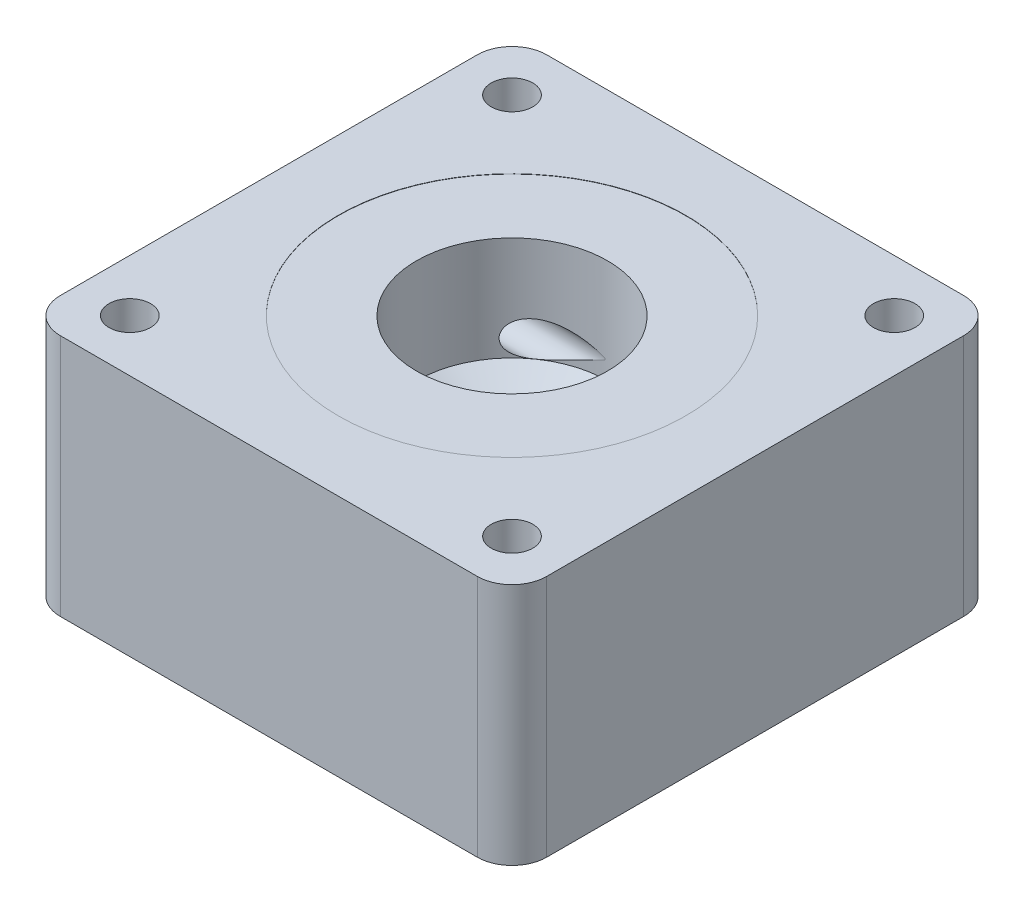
SolidWorks part; units mm, degrees
ref_plane "Front Plane" through (0, 0, 0) normal (0, 0, 1) x (1, 0, 0)
ref_plane "Top Plane" through (0, 0, 0) normal (0, 1, 0) x (1, 0, 0)
ref_plane "Right Plane" through (0, 0, 0) normal (1, 0, 0) x (0, 0, -1)
sketch "Sketch1" plane through (0, 0, 0) normal (0, 1, 0) x (1, 0, 0)
  line L1 (0, 0) -> (44.45, 0)
  line L2 (0, 0) -> (0, 44.45)
  line L3 (0, 44.45) -> (44.45, 44.45)
  line L4 (44.45, 0) -> (44.45, 44.45)
  dimension "D1" = 44.45
  dimension "D2" = 44.45
extrude "Boss-Extrude1" add sketch "Sketch1" along normal blind 22.225
hole_wizard "CSK for #6 Flat Head Socket Cap Screw1" positions "Sketch3" profile "Sketch2" countersink size "#6" standard "Ansi Inch"
sketch "Sketch3" plane through (11.91, 0, -3.9814) normal (0, 1, 0) x (-1, 0, 0)
  line L0 (11.91, -18.2436) -> (-32.54, -18.2436) construction
  line L1 (11.91, -40.4686) -> (11.91, 3.9814) construction
  line L2 (-32.54, 3.9814) -> (-32.54, -40.4686) construction
  line L3 (-10.315, 3.9814) -> (-10.315, -40.4686) construction
  line L4 (11.91, 3.9814) -> (-32.54, 3.9814) construction
  line L5 (-32.54, -40.4686) -> (11.91, -40.4686) construction
  point P0 (-27.7775, -35.7061)
  point P15 (7.1475, -35.7061)
  point P17 (-27.7775, -0.7811)
  point P18 (7.1475, -0.7811)
  dimension "D1" = 17.4625
  dimension "D2" = 17.4625
sketch "Sketch2" plane through (39.6875, 0, -39.6875) normal (1, 0, 0) x (0, 0, -1)
  line L0 (0, 0) -> (0, 22.225)
  line L1 (0, 22.225) -> (1.8986, 22.225)
  line L2 (1.8986, 22.225) -> (1.8986, 2.301)
  line L3 (1.8986, 2.301) -> (3.8989, 0)
  line L5 (3.8989, 0) -> (0, 0)
  line L6 (-1.8986, 2.301) -> (-3.8989, 0) construction
  line L11 (0, -6.35) -> (0, 107.95) construction
  dimension "Thru Hole Dia." = 3.7973
  dimension "Thru Hole Depth" = 22.225
  dimension "Near C'Sink Dia." = 7.7978
  dimension "Near C'Sink Angle" = 82
sketch "Sketch25" [suppressed] plane through (0, 19.1626, -22.3156) normal (1, 0, 0) x (0, 0, -1)
  line L0 (0, 3.175) -> (0, -3.175) construction
  line L1 (3.175, 0) -> (-3.175, 0) construction
  line L4 (-22.3156, 12.5874) -> (22.1344, 12.5874) construction
  point P5 (0, -3.2876)
  dimension "D1" = 15.875
  dimension "D3" = 6.35
ref_plane "Plane14" [suppressed] through (0, 15.875, -22.3156) normal (0, -1, 0) x (-1, 0, 0)
sketch "Port Sketch4" [suppressed] plane through (0, 15.875, -25.3729) normal (0, 1, 0) x (0, 0, 1)
  line L0 (3.0573, 0) -> (3.0573, 45.0293) construction
  line L1 (3.0573, 18.5806) -> (8.0179, 15.6)
  line L2 (8.0179, 15.6) -> (8.0179, 13.1)
  line L3 (8.0179, 13.1) -> (8.6136, 13.1)
  line L4 (8.6136, 13.1) -> (8.6136, 4.1104)
  line L5 (8.6136, 4.1104) -> (8.524, 4.2)
  line L6 (8.524, 4.2) -> (9.0339, 1.8012)
  line L7 (9.2823, 1.6) -> (13.5573, 1.6)
  line L8 (13.5573, 1.6) -> (13.5573, 0)
  line L10 (13.5573, 0) -> (3.0573, 0)
  line L11 (3.0573, 0) -> (3.0573, 18.5806)
  line L12 (-2.4093, 4.2) -> (-2.9192, 1.8012) construction
  line L13 (-2.4989, 4.1104) -> (-2.4093, 4.2) construction
  line L14 (3.0573, 18.5806) -> (-1.9033, 15.6) construction
  arc A0 (9.0339, 1.8012) -> (9.2823, 1.6) centre (9.2823, 1.854) ccw
  dimension "D1" = 0.254
  dimension "Countersink angle" = 118
  dimension "D3" = 45
  dimension "TapDrillDia" = 9.9212
  dimension "D5" = 12.45
  dimension "ThdMjr" = 11.1125
  dimension "SpotDia" = 21
  dimension "L3" = 1.6
  dimension "L1" = 2.6
  dimension "ThdDp" = 11.5
  dimension "TapDrillDp" = 14
  dimension "K" = 12
revolve "SAE Port4" [suppressed] cut sketch "Port Sketch4" angle 360 about L0
other "sae j1926-1 (circular face)<2>" [suppressed]
sketch "Sketch29" plane through (0, 0, 0) normal (0, 0, 1) x (1, 0, 0)
  line L0 (0, 22.225) -> (44.45, 22.225) construction
  line L1 (44.45, 22.225) -> (44.45, 0) construction
  point P0 (22.225, 3.175)
  dimension "D1" = 19.05
  dimension "D2" = 22.225
sketch "Sketch211" [suppressed] plane through (22.1542, 19.113, 0) normal (0, 0, -1) x (-1, 0, 0)
  line L0 (0, 3.175) -> (0, -3.175) construction
  line L1 (3.175, 0) -> (-3.175, 0) construction
  line L3 (-22.2958, 12.637) -> (-22.2958, -19.113) construction
  line L4 (22.1542, 12.637) -> (-22.2958, 12.637) construction
  point P5 (-0.0708, -3.238)
  dimension "D1" = 22.225
  dimension "D2" = 15.875
ref_plane "Plane18" [suppressed] through (22.225, 15.875, 0) normal (0, -1, 0) x (-1, 0, 0)
sketch "Port Sketch8" [suppressed] plane through (19.1677, 15.875, 0) normal (0, 1, 0) x (1, 0, 0)
  line L0 (2.9865, 0) -> (2.9865, 45.0293) construction
  line L1 (2.9865, 18.5806) -> (7.9471, 15.6)
  line L2 (7.9471, 15.6) -> (7.9471, 13.1)
  line L3 (7.9471, 13.1) -> (8.5427, 13.1)
  line L4 (8.5427, 13.1) -> (8.5427, 4.1104)
  line L5 (8.5427, 4.1104) -> (8.4532, 4.2)
  line L6 (8.4532, 4.2) -> (8.963, 1.8012)
  line L7 (9.2115, 1.6) -> (13.4865, 1.6)
  line L8 (13.4865, 1.6) -> (13.4865, 0)
  line L10 (13.4865, 0) -> (2.9865, 0)
  line L11 (2.9865, 0) -> (2.9865, 18.5806)
  line L12 (-2.4802, 4.2) -> (-2.9901, 1.8012) construction
  line L13 (-2.5698, 4.1104) -> (-2.4802, 4.2) construction
  line L14 (2.9865, 18.5806) -> (-1.9741, 15.6) construction
  arc A0 (8.963, 1.8012) -> (9.2115, 1.6) centre (9.2115, 1.854) ccw
  dimension "D1" = 0.254
  dimension "Countersink angle" = 118
  dimension "D3" = 45
  dimension "TapDrillDia" = 9.9212
  dimension "D5" = 12.45
  dimension "ThdMjr" = 11.1125
  dimension "SpotDia" = 21
  dimension "L3" = 1.6
  dimension "L1" = 2.6
  dimension "ThdDp" = 11.5
  dimension "TapDrillDp" = 14
  dimension "K" = 12
revolve "SAE Port8" [suppressed] cut sketch "Port Sketch8" angle 360 about L0
other "sae j1926-1 (circular face)<3>" [suppressed]
hole_wizard "11/16 (0.6875) Diameter Hole1" positions "Sketch215" profile "Sketch214" hole size "11/16" standard "Ansi Inch"
sketch "Sketch215" plane through (0, 22.225, 0) normal (0, 1, 0) x (-1, 0, 0)
  line L0 (0, -44.45) -> (0, 0) construction
  line L1 (0, 0) -> (-44.45, 0) construction
  point P0 (-22.225, -22.225)
  dimension "D1" = 22.225
  dimension "D2" = 22.225
sketch "Sketch214" plane through (22.225, 22.225, -22.225) normal (1, 0, 0) x (0, 0, 1)
  line L0 (0, 0) -> (0, 14.7713)
  line L1 (0, 14.7713) -> (8.7312, 9.525)
  line L2 (8.7312, 9.525) -> (8.7312, 0)
  line L5 (8.7312, 0) -> (0, 0)
  line L10 (0, 14.7713) -> (-8.7312, 9.525) construction
  line L11 (0, -6.35) -> (0, 107.95) construction
  dimension "Hole Dia." = 17.4625
  dimension "Hole Depth" = 9.525
  dimension "Drill Angle" = 118
sketch "Sketch220" plane through (0, 22.225, 0) normal (0, 1, 0) x (1, 0, 0)
  circle A0 centre (22.225, 22.225) radius 15.875
  dimension "D1" = 31.75
extrude "Cut-Extrude1" cut sketch "Sketch220" against normal blind 0.0254
fillet "Fillet1" radius 3.175 4 edges at (0, 11.1125, 0) (0, 11.1125, -44.45) (44.45, 11.1125, 0) (44.45, 11.1125, -44.45)
sketch "Sketch212" plane through (22.226, 0, -21.0302) normal (0, 1, 0) x (-1, 0, 0)
  line L0 (0, 3.175) -> (0, -3.175) construction
  line L1 (3.175, 0) -> (-3.175, 0) construction
  line L2 (22.226, -20.2448) -> (22.226, 17.8552) construction
  line L3 (19.051, 21.0302) -> (-19.049, 21.0302) construction
  point P5 (0.001, -1.1948)
  dimension "D1" = 22.225
  dimension "D2" = 22.225
  dimension "D3" = 6.35
ref_plane "Plane1" through (22.225, 0, -22.225) normal (0, 0, -1) x (-1, 0, 0)
sketch "Port Sketch" plane through (19.1677, 0, -22.225) normal (0, 0, 1) x (1, 0, 0)
  line L0 (3.0583, 0) -> (3.0583, 45.0293) construction
  line L1 (3.0583, 18.5806) -> (8.0189, 15.6)
  line L2 (8.0189, 15.6) -> (8.0189, 13.1)
  line L3 (8.0189, 13.1) -> (8.6146, 13.1)
  line L4 (8.6146, 13.1) -> (8.6146, 4.1104)
  line L5 (8.6146, 4.1104) -> (8.525, 4.2)
  line L6 (8.525, 4.2) -> (9.0349, 1.8012)
  line L7 (9.2833, 1.6) -> (13.5583, 1.6)
  line L8 (13.5583, 1.6) -> (13.5583, 0)
  line L10 (13.5583, 0) -> (3.0583, 0)
  line L11 (3.0583, 0) -> (3.0583, 18.5806)
  line L12 (-2.4083, 4.2) -> (-2.9182, 1.8012) construction
  line L13 (-2.4979, 4.1104) -> (-2.4083, 4.2) construction
  line L14 (3.0583, 18.5806) -> (-1.9023, 15.6) construction
  arc A0 (9.0349, 1.8012) -> (9.2833, 1.6) centre (9.2833, 1.854) ccw
  dimension "D1" = 0.254
  dimension "Countersink angle" = 118
  dimension "D3" = 45
  dimension "TapDrillDia" = 9.9212
  dimension "D5" = 12.45
  dimension "ThdMjr" = 11.1125
  dimension "SpotDia" = 21
  dimension "L3" = 1.6
  dimension "L1" = 2.6
  dimension "ThdDp" = 11.5
  dimension "TapDrillDp" = 14
  dimension "K" = 12
revolve "SAE Port" cut sketch "Port Sketch" angle 360 about L0
other "sae j1926-1 (circular face)<4>"
hole_wizard "1/4-28 Tapped Hole1" positions "Sketch231" profile "Sketch230" tap size "1/4-28" standard "Ansi Inch"
sketch "Sketch231" plane through (0, 0, 0) normal (-1, 0, 0) x (0, 0, 1)
  line L0 (-41.275, 22.225) -> (-3.175, 22.225) construction
  line L1 (-22.225, -1.6698) -> (-22.225, 23.7256) construction
  line L2 (-22.225, 0) -> (-22.225, -5.8413) construction
  line L3 (-41.275, 0) -> (-3.175, 0) construction
  point P0 (-29.3675, 14.2875)
  point P14 (-15.0825, 14.2875)
  dimension "D1" = 7.9375
  dimension "D2" = 7.1425
sketch "Sketch230" plane through (0, 14.2875, -29.3675) normal (0, 1, 0) x (0, 0, 1)
  line L0 (0, 0) -> (0, 8.89)
  line L1 (0, 8.89) -> (2.7051, 8.89)
  line L2 (2.7051, 8.89) -> (2.7051, 0)
  line L5 (2.7051, 0) -> (0, 0)
  line L10 (0, 8.89) -> (-2.7051, 8.89) construction
  line L11 (0, -6.35) -> (0, 107.95) construction
  dimension "Tap Drill Dia." = 5.4102
  dimension "Tap Drill Depth" = 8.89
  dimension "Drill Angle" = 180
sketch "Sketch232" plane through (8.89, 0, 0) normal (-1, 0, 0) x (0, 0, 1)
  circle A0 centre (-29.3675, 14.2875) radius 1.5875
  circle A1 centre (-15.0825, 14.2875) radius 1.5875
  dimension "D1" = 3.175
  dimension "D2" = 3.175
extrude "Cut-Extrude2" cut sketch "Sketch232" against normal blind 13.0962
hole_wizard "#10-24 Tapped Hole1" positions "Sketch234" profile "Sketch233" tap size "#10-24" standard "Ansi Inch"
sketch "Sketch234" plane through (0, 0, 0) normal (0, -1, 0) x (1, 0, 0)
  line L0 (44.45, -22.225) -> (0, -22.225) construction
  line L1 (44.45, -3.175) -> (44.45, -41.275) construction
  line L2 (0, -41.275) -> (0, -3.175) construction
  line L3 (22.225, 0) -> (22.225, -44.45) construction
  line L4 (3.175, 0) -> (41.275, 0) construction
  line L5 (41.275, -44.45) -> (3.175, -44.45) construction
  point P0 (22.225, -3.175)
  point P16 (22.225, -41.275)
  point P17 (41.275, -22.225)
  point P21 (3.175, -22.225)
  dimension "D1" = 3.175
  dimension "D2" = 3.175
sketch "Sketch233" plane through (22.225, 0, -3.175) normal (1, 0, 0) x (0, 0, -1)
  line L0 (0, 0) -> (0, 22.225)
  line L1 (0, 22.225) -> (1.8986, 22.225)
  line L2 (1.8986, 22.225) -> (1.8986, 0)
  line L5 (1.8986, 0) -> (0, 0)
  line L11 (0, -6.35) -> (0, 107.95) construction
  dimension "Thru Tap Drill Dia." = 3.7973
  dimension "Thru Tap Drill Depth" = 22.225
equation "\"Buoyancy\"=\"SW-Volume\"*(\"SW-Density\"-.037062)"
